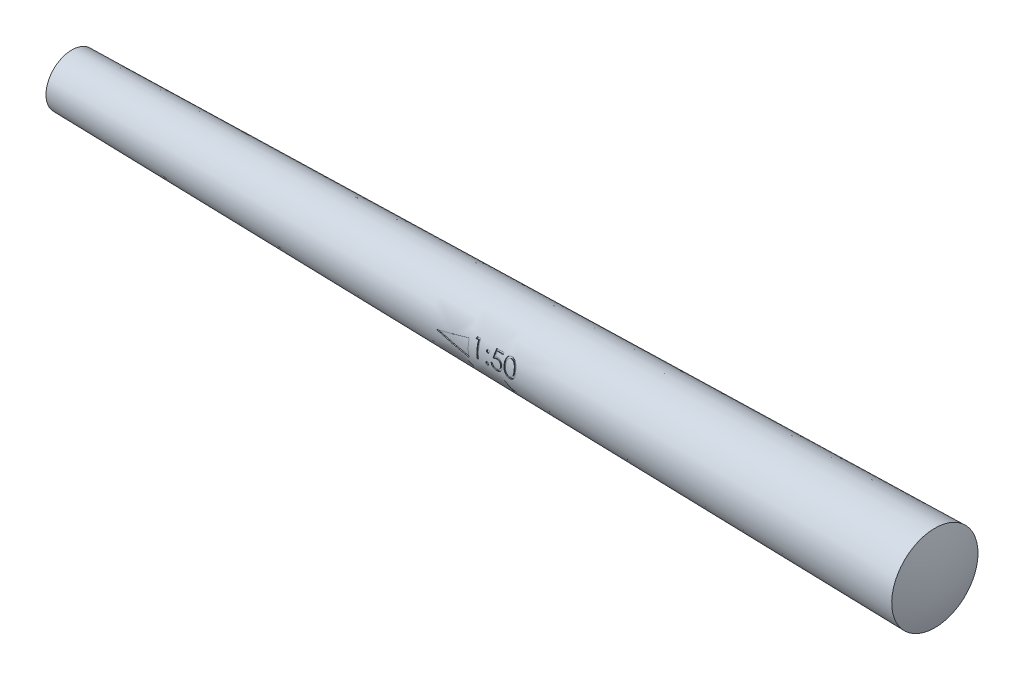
SolidWorks part; units mm, degrees
ref_plane "Front Plane" through (0, 0, 0) normal (0, 0, 1) x (1, 0, 0)
ref_plane "Top Plane" through (0, 0, 0) normal (0, 1, 0) x (1, 0, 0)
ref_plane "Right Plane" through (0, 0, 0) normal (1, 0, 0) x (0, 0, -1)
sketch "Sketch1" plane through (0, 0, 0) normal (1, 0, 0) x (0, 0, -1)
  circle A0 centre (0, 0) radius 1.5
  dimension "D1" = 3
extrude "Extrude1" add sketch "Sketch1" along normal mid plane 50
draft "Draft1" type of draft neutral plane draft angle 1.146 faces to draft 1 parameters "D1"=1.146
sketch "Sketch2" plane through (0, 0, 0) normal (0, 0, 1) x (1, 0, 0)
  line L0 (-25, 0) -> (-25, 1.5)
  line L1 (-25, 1.5) -> (-25, -1.5) construction
  line L2 (-25, 0) -> (-25.45, 0)
  line L3 (-25.45, 0) -> (-25.45, -2) construction
  line L4 (25, 0) -> (25, 2.5)
  line L5 (25, -2.5) -> (25, 2.5) construction
  line L6 (25, 0) -> (25.45, 0)
  line L7 (25.45, 0) -> (25.45, -2) construction
  line L8 (-25, -1.5) -> (25, -2.5) construction
  arc A0 (-25.45, 0) -> (-25, 1.5) centre (-22.725, 0) cw
  arc A1 (25.45, 0) -> (25, 2.5) centre (18.2804, 0) ccw
  point P14 (0, -2)
revolve "Revolve1" add sketch "Sketch2" angle 360 about L2
sketch "Sketch5" plane through (0, 0, 0) normal (0, 0, 1) x (1, 0, 0)
  line L0 (0, 2) -> (0, -2) construction
  line L1 (25, 2.5) -> (-25, 1.5) construction
  line L2 (-25, -1.5) -> (25, -2.5) construction
ref_plane "Plane2" through (0, 0, 0) normal (-0.02, 0, 0.9998) x (0.9998, 0, 0.02)
sketch "Sketch6" plane through (0, 0, 0) normal (-0.02, 0, 0.9998) x (0.9998, 0, 0.02)
  line L0 (0, 0) -> (0, 0.5)
  line L1 (0, 2) -> (0, -2) construction
  line L2 (0, 0.5) -> (-1.866, 0)
  line L3 (-1.866, 0) -> (0, -0.5)
  line L4 (0, -0.5) -> (0, 0)
  line L5 (0, -0.25) -> (3, -0.25) construction
  text T0 "1:50" font "Century Gothic" height 1
  dimension "D1" = 1
  dimension "D2" = 30
  dimension "D3" = 3
wrap "Wrap2" sketch "Sketch6" wrap type deboss source sketch "Sketch6" thickness 0.05 parameters "D1"=0.05
equation "\"D2@Sketch2\" = \"D1@Sketch2\""
